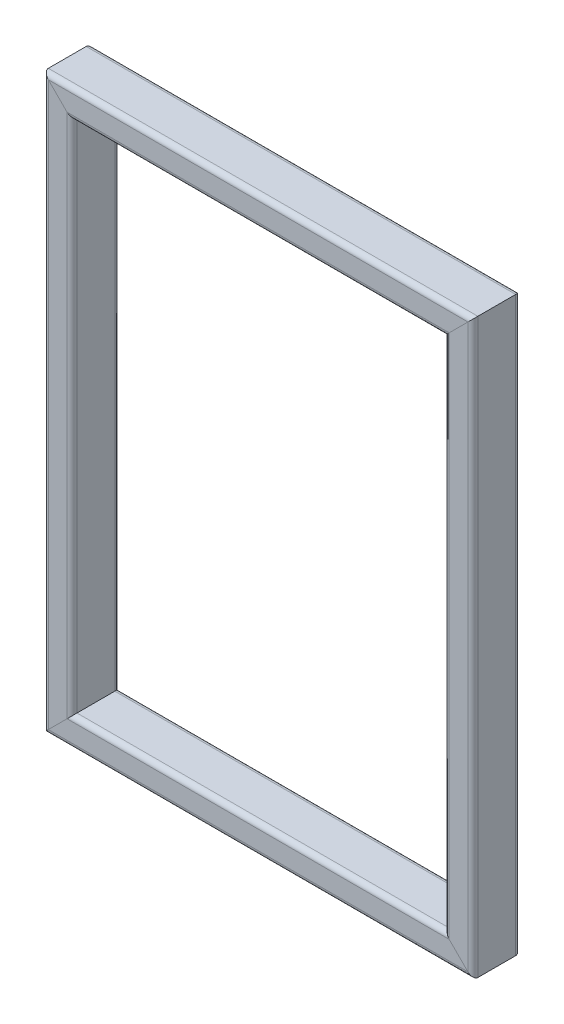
SolidWorks part; units mm, degrees
ref_plane "Front Plane" through (0, 0, 0) normal (0, 0, 1) x (1, 0, 0)
ref_plane "Top Plane" through (0, 0, 0) normal (0, 1, 0) x (1, 0, 0)
ref_plane "Right Plane" through (0, 0, 0) normal (1, 0, 0) x (0, 0, -1)
sketch "Sketch1" plane through (0, 0, 0) normal (0, 0, 1) x (1, 0, 0)
  line L1 (0, 0) -> (-450, 0)
  line L2 (0, 0) -> (0, 600)
  line L3 (0, 600) -> (-450, 600)
  line L4 (-450, 0) -> (-450, 600)
  dimension "D1" = 450
  dimension "D2" = 600
other "Structural Member1"
ref_plane "Plane1" through (-450, 0, 0) normal (0, 1, 0) x (-1, 0, 0)
sketch "Sketch13" plane through (-435, 0, -25) normal (0, 1, 0) x (-1, 0, 0)
  line L0 (-9.8, -22.4) -> (9.8, -22.4)
  line L1 (-12.4, -19.8) -> (-12.4, 19.8)
  line L2 (9.8, 22.4) -> (-9.8, 22.4)
  line L3 (12.4, 19.8) -> (12.4, -19.8)
  line L4 (-9.8, -25) -> (9.8, -25)
  line L5 (-15, -19.8) -> (-15, 19.8)
  line L6 (9.8, 25) -> (-9.8, 25)
  line L7 (15, 19.8) -> (15, -19.8)
  arc A0 (15, 19.8) -> (9.8, 25) centre (9.8, 19.8) ccw
  arc A1 (9.8, -25) -> (15, -19.8) centre (9.8, -19.8) ccw
  arc A2 (-15, -19.8) -> (-9.8, -25) centre (-9.8, -19.8) ccw
  arc A3 (-9.8, 25) -> (-15, 19.8) centre (-9.8, 19.8) ccw
  arc A4 (-9.8, 22.4) -> (-12.4, 19.8) centre (-9.8, 19.8) ccw
  arc A5 (12.4, 19.8) -> (9.8, 22.4) centre (9.8, 19.8) ccw
  arc A6 (9.8, -22.4) -> (12.4, -19.8) centre (9.8, -19.8) ccw
  arc A7 (-12.4, -19.8) -> (-9.8, -22.4) centre (-9.8, -19.8) ccw
  point P0 (0, 25)
  point P1 (15, 0)
  point P2 (0, -25)
  point P3 (-15, 0)
  point P4 (-15, 25)
  point P5 (15, 25)
  point P6 (15, -25)
  point P7 (-15, -25)
  point P8 (0, 0)
  point P33 (0, 0)
  dimension "D1" = 5.2
  dimension "Thickness" = 2.6
  dimension "V_leg" = 50
  dimension "H_leg" = 30
